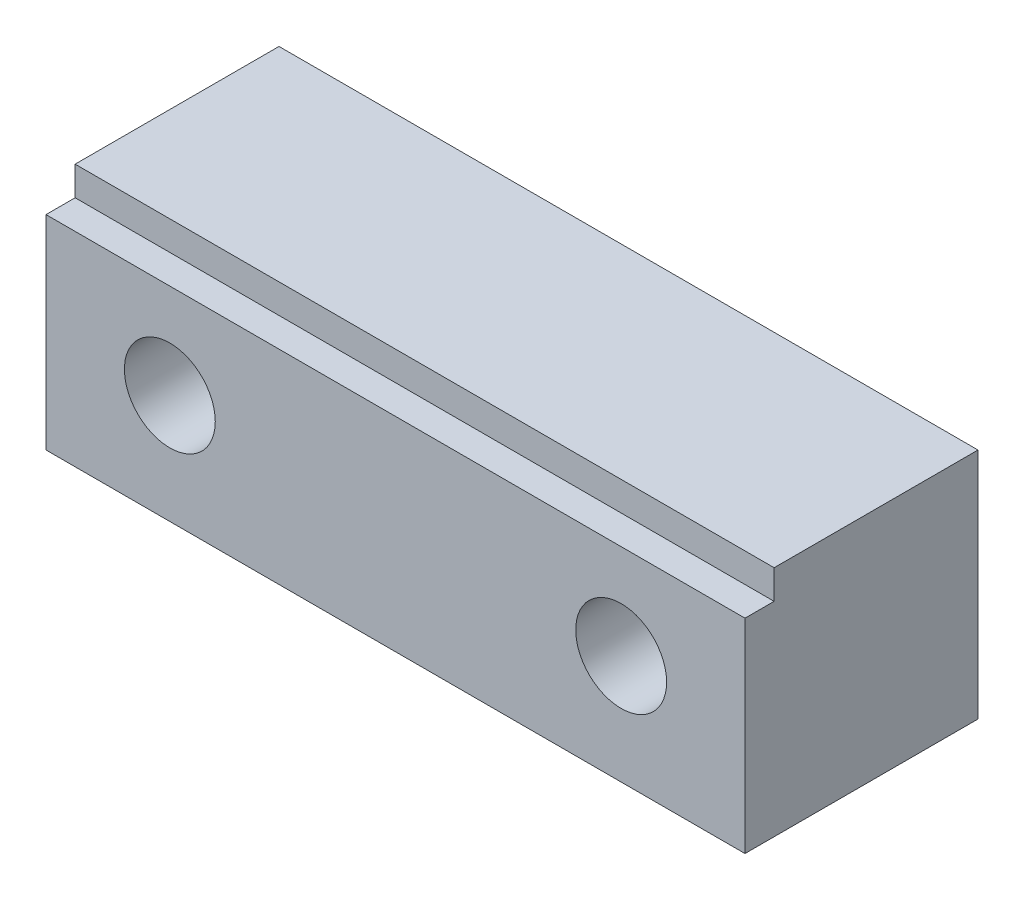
SolidWorks part; units mm, degrees
ref_plane "Front Plane" through (0, 0, 0) normal (0, 0, 1) x (1, 0, 0)
ref_plane "Top Plane" through (0, 0, 0) normal (0, 1, 0) x (1, 0, 0)
ref_plane "Right Plane" through (0, 0, 0) normal (1, 0, 0) x (0, 0, -1)
sketch "Sketch1" plane through (0, 0, 0) normal (0, 1, 0) x (1, 0, 0)
  line L1 (-76.2, 25.4) -> (76.2, 25.4)
  line L2 (-76.2, 25.4) -> (-76.2, -25.4)
  line L3 (-76.2, -25.4) -> (76.2, -25.4)
  line L4 (76.2, 25.4) -> (76.2, -25.4)
  line L5 (-76.2, 25.4) -> (76.2, -25.4) construction
  line L6 (-76.2, -25.4) -> (76.2, 25.4) construction
  point P0 (0, 0)
  dimension "D1" = 50.8
  dimension "D2" = 152.4
extrude "Boss-Extrude1" add sketch "Sketch1" against normal blind 50.8
sketch "Sketch2" plane through (0, 0, 25.4) normal (0, 0, 1) x (1, 0, 0)
  line L0 (-76.2, -50.8) -> (-76.2, 0) construction
  line L1 (-76.2, -50.8) -> (76.2, -50.8) construction
  line L2 (0, 0) -> (0, -65.8424) construction
  circle A0 centre (-49.1998, -27.0002) radius 9.906
  circle A1 centre (49.1998, -27.0002) radius 9.906
  dimension "D3" = 19.812
  dimension "D1" = 27.0002
  dimension "D2" = 23.7998
extrude "Cut-Extrude1" cut sketch "Sketch2" against normal offset from surface (41.402 mm away) 9.398
sketch "Sketch3" plane through (0, 0, 25.4) normal (0, 0, 1) x (1, 0, 0)
  circle A0 centre (-49.1998, -27.0002) radius 6.7437
  circle A1 centre (49.1998, -27.0002) radius 6.7437
  dimension "D1" = 13.4874
extrude "Cut-Extrude2" cut sketch "Sketch3" against normal through all
sketch "Sketch4" plane through (76.2, 0, 0) normal (1, 0, 0) x (0, 0, -1)
  line L1 (-25.4, 0) -> (-19.05, 0)
  line L2 (-25.4, 0) -> (-25.4, -6.35)
  line L3 (-25.4, -6.35) -> (-19.05, -6.35)
  line L4 (-19.05, 0) -> (-19.05, -6.35)
  dimension "D1" = 6.35
  dimension "D2" = 6.35
extrude "Cut-Extrude3" cut sketch "Sketch4" against normal through all
